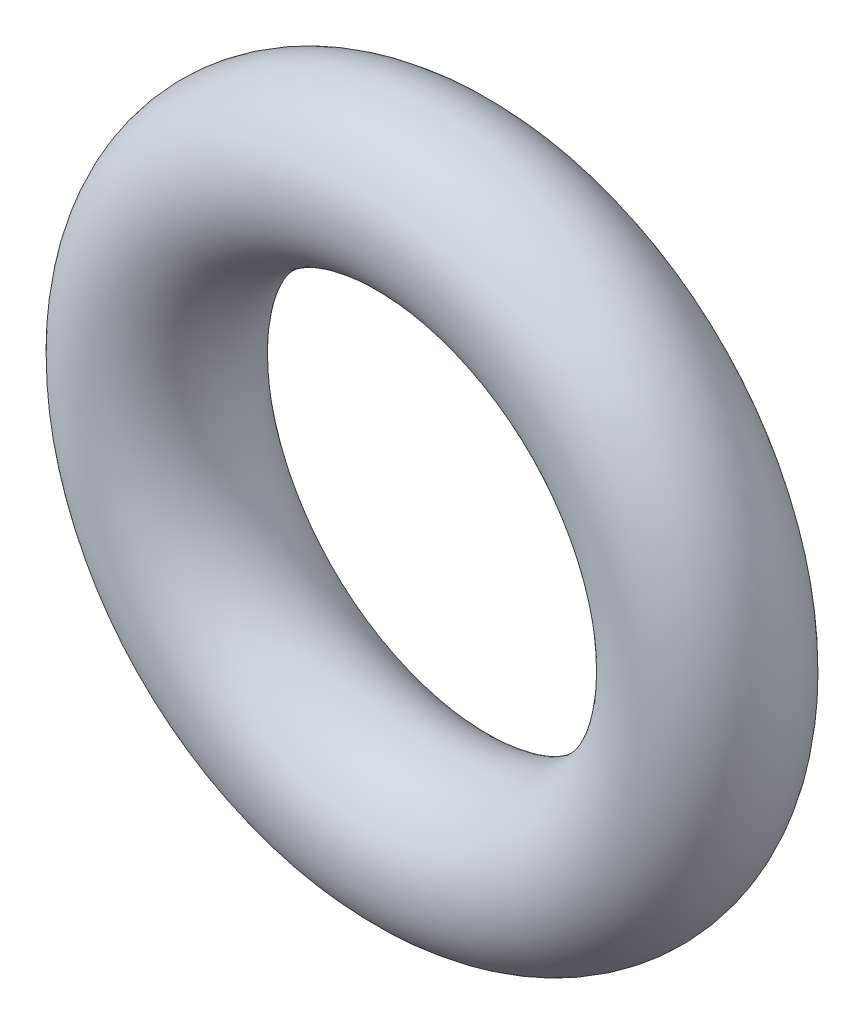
SolidWorks part; units mm, degrees
ref_plane "Front" through (0, 0, 0) normal (0, 0, 1) x (1, 0, 0)
ref_plane "Top" through (0, 0, 0) normal (0, 1, 0) x (1, 0, 0)
ref_plane "Right" through (0, 0, 0) normal (1, 0, 0) x (0, 0, -1)
sketch "Sketch1" plane through (0, 0, 0) normal (1, 0, 0) x (0, -1, 0)
  line L0 (0, -0.889) -> (0, 0.889) construction
  line L2 (-4.4145, 0) -> (4.4145, 0) construction
  line L3 (-2.2352, 0) -> (2.2352, 0) construction
  circle A0 centre (3.1242, 0) radius 0.889
  point P9 (2.2352, 0)
  point P10 (4.0132, 0)
  point P13 (3.1242, 0.889)
  point P14 (3.1242, -0.889)
  dimension "Width" = 1.778
  dimension "ID" = 4.4704
revolve "Revolve1" add sketch "Sketch1" angle 360 about L0
sketch "Sketch2" plane through (0, 0, 0) normal (1, 0, 0) x (0, 0, -1)
  line L0 (0, 0) -> (-0.869, 0)
